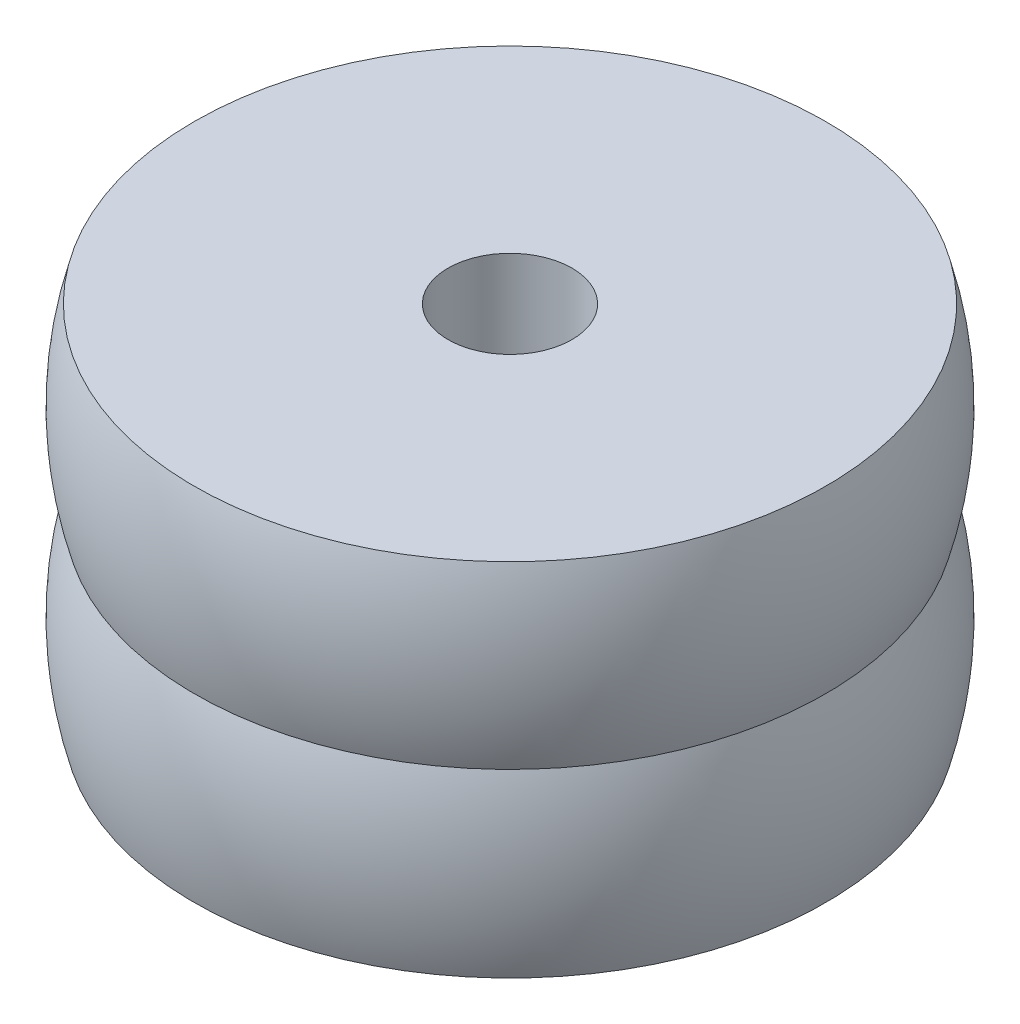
SolidWorks part; units mm, degrees
ref_plane "Face" through (0, 0, 0) normal (0, 0, 1) x (1, 0, 0)
ref_plane "Dessus" through (0, 0, 0) normal (0, 1, 0) x (1, 0, 0)
ref_plane "Droite" through (0, 0, 0) normal (1, 0, 0) x (0, 0, -1)
sketch "Esquisse1" plane through (0, 0, 0) normal (0, 0, 1) x (1, 0, 0)
  line L0 (-43.3084, 49.4422) -> (-8.5, 49.4422)
  line L1 (-43.309, 0) -> (-8.5, 0)
  line L3 (-8.5, 49.4422) -> (-8.5, 0)
  line L6 (0, -3.0776) -> (0, 122.4834) construction
  arc A2 (-43.229, 24.72) -> (-43.309, 0) centre (0, 12.22) ccw
  arc A3 (-43.3084, 49.4422) -> (-43.229, 24.72) centre (0, 37.22) ccw
  dimension "D2" = 45
  dimension "D1" = 8.5
  dimension "D4" = 12.22
  dimension "D5" = 12.2222
  dimension "D6" = 25
revolve "Base-Révolution" add sketch "Esquisse1" angle 360 about L6
